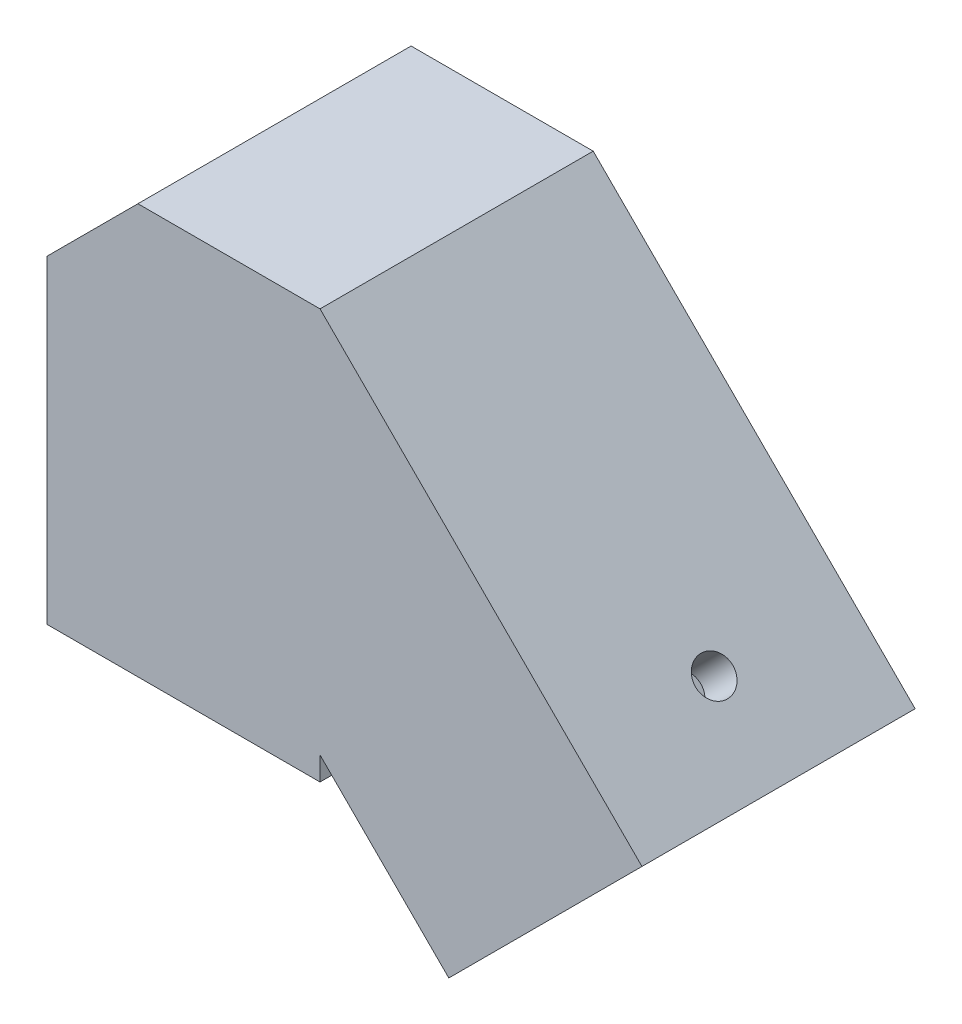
SolidWorks part; units mm, degrees
ref_plane "Alzado" through (0, 0, 0) normal (0, 0, 1) x (1, 0, 0)
ref_plane "Planta" through (0, 0, 0) normal (0, 1, 0) x (1, 0, 0)
ref_plane "Vista lateral" through (0, 0, 0) normal (1, 0, 0) x (0, 0, -1)
sketch "Croquis2" plane through (0, 0, 0) normal (0, 1, 0) x (1, 0, 0)
  line L1 (-15, -15) -> (15, -15)
  line L2 (-15, -15) -> (-15, 15)
  line L3 (-15, 15) -> (15, 15)
  line L4 (15, -15) -> (15, 15)
  line L5 (-15, -15) -> (15, 15) construction
  line L6 (-15, 15) -> (15, -15) construction
  point P0 (0, 0)
  dimension "D1" = 30
  dimension "D2" = 30
extrude "Saliente-Extruir1" add sketch "Croquis2" along normal blind 20 and the other way blind 25
sketch "Croquis3" plane through (0, 0, 15) normal (0, 0, 1) x (1, 0, 0)
  line L0 (15, 20) -> (50.3553, -15.3553)
  line L1 (15, -25) -> (15, 20) construction
  line L4 (15, -22.4264) -> (15, 20)
  line L5 (15, -22.4264) -> (29.1421, -36.5685)
  line L6 (29.1421, -36.5685) -> (50.3553, -15.3553)
  dimension "D1" = 45
  dimension "D2" = 90
  dimension "D3" = 50
  dimension "D4" = 30
extrude "Saliente-Extruir2" add sketch "Croquis3" against normal up to surface (30 mm away)
sketch "Croquis4" plane through (0, -25, 0) normal (0, -1, 0) x (1, 0, 0)
  line L1 (-10.025, -10.025) -> (10.025, -10.025)
  line L2 (-10.025, -10.025) -> (-10.025, 10.025)
  line L3 (-10.025, 10.025) -> (10.025, 10.025)
  line L4 (10.025, -10.025) -> (10.025, 10.025)
  line L5 (-10.025, -10.025) -> (10.025, 10.025) construction
  line L6 (-10.025, 10.025) -> (10.025, -10.025) construction
  point P0 (0, 0)
  dimension "D1" = 20.05
  dimension "D2" = 20.05
extrude "Cortar-Extruir1" cut sketch "Croquis4" against normal blind 20
sketch "Croquis5" plane through (32.8553, -32.8553, 0) normal (0.7071, -0.7071, 0) x (0, 0, -1)
  line L0 (15, 24.7487) -> (-15, 24.7487) construction
  line L6 (-10.025, -0.2763) -> (10.025, -0.2763)
  line L8 (-10.025, -0.2763) -> (-10.025, 19.7737)
  line L9 (-10.025, 19.7737) -> (10.025, 19.7737)
  line L10 (10.025, -0.2763) -> (10.025, 19.7737)
  line L11 (-10.025, -0.2763) -> (10.025, 19.7737) construction
  line L12 (-10.025, 19.7737) -> (10.025, -0.2763) construction
  point P0 (0, 9.7487)
  dimension "D1" = 20.05
  dimension "D2" = 20.05
  dimension "D3" = 15
extrude "Cortar-Extruir2" cut sketch "Croquis5" along a picked direction on the side against the normal blind 25
chamfer "Chaflán1" distance 10 angle 45 1 edges at (-15, 20, 0)
sketch "Croquis6" plane through (17.5, 17.5, 0) normal (0.7071, 0.7071, 0) x (0, 0, -1)
  line L0 (15, -46.4645) -> (-15, -46.4645) construction
  circle A0 centre (0, -36.4645) radius 2.05
  dimension "D1" = 4.1
  dimension "D2" = 10
extrude "Cortar-Extruir3" cut sketch "Croquis6" against normal up to surface (4.975 mm away) contours A0
sketch "Croquis7" plane through (-15, 0, 0) normal (-1, 0, 0) x (0, 0, 1)
  line L0 (-15, -25) -> (15, -25) construction
  circle A0 centre (0, -15) radius 2.05
  dimension "D1" = 4.1
  dimension "D2" = 10
extrude "Cortar-Extruir4" cut sketch "Croquis7" against normal up to surface (4.975 mm away)
